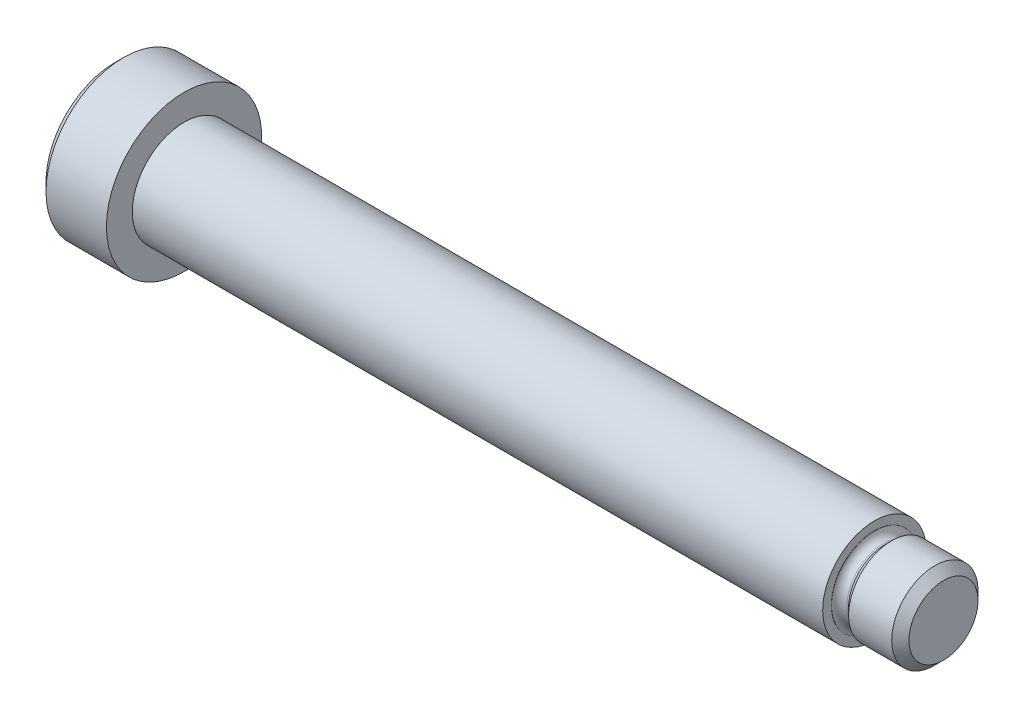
SolidWorks part; units mm, degrees
ref_plane "Face" through (0, 0, 0) normal (0, 0, 1) x (1, 0, 0)
ref_plane "Dessus" through (0, 0, 0) normal (0, 1, 0) x (1, 0, 0)
ref_plane "Droite" through (0, 0, 0) normal (1, 0, 0) x (0, 0, -1)
sketch "Esquisse1" plane through (0, 0, 0) normal (0, 0, 1) x (1, 0, 0)
  line L0 (0, 0) -> (159.9707, 0) construction
  line L1 (0, 0) -> (0, 4.5)
  line L2 (0, 4.5) -> (4, 4.5)
  line L3 (4, 4.5) -> (4, 3)
  line L4 (4, 3) -> (44, 3)
  line L5 (44, 3) -> (44, 2.5)
  line L6 (44, 2.5) -> (48, 2.5)
  line L7 (48, 2.5) -> (48, 0)
  line L8 (48, 0) -> (0, 0)
  dimension "D1" = 4
  dimension "D2" = 40
  dimension "D3" = 4
  dimension "D4" = 9
  dimension "D5" = 6
  dimension "D6" = 5
revolve "Révolution1" add sketch "Esquisse1" angle 360 about L0
chamfer "Chanfrein1" distance 0.5 angle 45 2 edges at (0, 0, 4.5) (48, 0, 2.5)
sketch "Esquisse2" plane through (0, 0, 0) normal (-1, 0, 0) x (0, 0, 1)
  line L1 (0, -2.3671) -> (2.05, -1.1836)
  line L2 (2.05, -1.1836) -> (2.05, 1.1836)
  line L3 (2.05, 1.1836) -> (0, 2.3671)
  line L4 (0, 2.3671) -> (-2.05, 1.1836)
  line L5 (-2.05, 1.1836) -> (-2.05, -1.1836)
  line L6 (-2.05, -1.1836) -> (0, -2.3671)
  circle A0 centre (0, 0) radius 2.05 construction
  dimension "D1" = 4.1
extrude "Enlèv. mat.-Extru.1" cut sketch "Esquisse2" against normal blind 3
sketch "Esquisse3" plane through (0, 0, 0) normal (0, 1, 0) x (1, 0, 0)
  line L0 (44, 3) -> (44, 2.6)
  line L1 (44.5, 2.1) -> (44.6, 2.1)
  line L2 (44.6, 2.1) -> (45, 2.5)
  line L3 (45, 2.5) -> (45, 3)
  line L4 (45, 3) -> (44, 3)
  line L5 (-50, 0) -> (50, 0) construction
  line L7 (0, 0) -> (81.34, 0) construction
  line L8 (47.5, 2.5) -> (44, 2.5) construction
  line L11 (44, -3) -> (44, 3) construction
  line L13 (44, 3) -> (4, 3) construction
  arc A0 (44, 2.6) -> (44.5, 2.1) centre (44.5, 2.6) ccw
  dimension "D4" = 0.5
  dimension "D1" = 1
  dimension "D2" = 45
  dimension "D3" = 4.2
revolve "Enlèvement de matière-Révolution1" cut sketch "Esquisse3" angle 360 about L7
